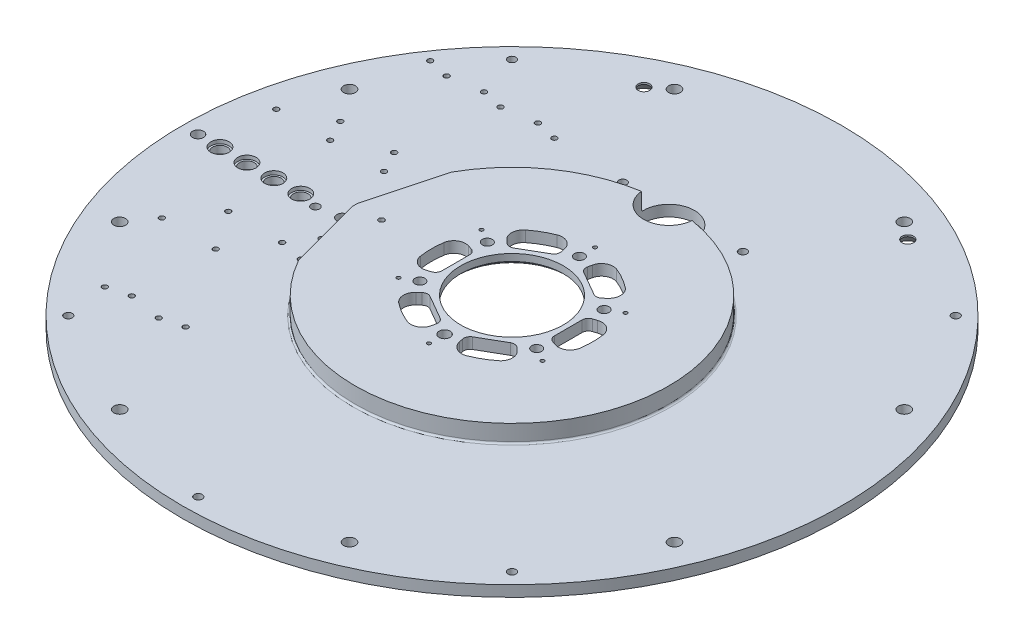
SolidWorks part; units mm, degrees
ref_plane "Front Plane" through (0, 0, 0) normal (0, 0, 1) x (1, 0, 0)
ref_plane "Top Plane" through (0, 0, 0) normal (0, 1, 0) x (1, 0, 0)
ref_plane "Right Plane" through (0, 0, 0) normal (1, 0, 0) x (0, 0, -1)
sketch "Sketch1" plane through (0, 0, 0) normal (0, 0, 1) x (1, 0, 0)
  line L0 (0, 0) -> (0, 40.0271) construction
  line L1 (-67.945, 0) -> (-142.748, 0)
  line L2 (-142.748, 0) -> (-142.748, -4.7625)
  line L3 (-61.9125, -4.7625) -> (-142.748, -4.7625)
  line L4 (-23.8125, 4.6355) -> (-23.8125, 2.8575)
  line L5 (-67.945, 0) -> (-67.945, 7.62)
  line L6 (-67.945, 7.62) -> (-24.003, 7.62)
  line L7 (-61.9125, -4.7625) -> (-61.9125, 2.8575)
  line L8 (-61.9125, 2.8575) -> (-23.8125, 2.8575)
  line L9 (-24.003, 7.62) -> (-22.225, 7.62)
  line L10 (-22.225, 7.62) -> (-22.225, 4.6355)
  line L11 (-22.225, 4.6355) -> (-23.8125, 4.6355)
  dimension "D1" = 285.496
  dimension "D2" = 4.7625
  dimension "D3" = 47.625
  dimension "D4" = 4.7625
  dimension "D5" = 135.89
  dimension "D6" = 123.825
  dimension "D7" = 7.62
  dimension "D8" = 12.3825
  dimension "D9" = 44.45
  dimension "D10" = 1.778
revolve "Revolve1" add sketch "Sketch1" angle 360 about L0
hole_wizard "#8-32 Tapped Hole1" positions "Sketch8" profile "Sketch7" tap size "#8-32" standard "ANSI Inch"
sketch "Sketch8" plane through (0, 0, 0) normal (0, 1, 0) x (1, 0, 0)
  line L0 (0, -135.89) -> (0, 0) construction
  point P0 (0, -135.89)
  dimension "D1" = 135.89
sketch "Sketch7" plane through (0, 0, 135.89) normal (1, 0, 0) x (0, 0, 1)
  line L0 (0, 0) -> (0, 4.7625)
  line L1 (0, 4.7625) -> (1.7272, 4.7625)
  line L2 (1.7272, 4.7625) -> (1.7272, 0)
  line L5 (1.7272, 0) -> (0, 0)
  line L11 (0, -6.35) -> (0, 107.95) construction
  dimension "Thru Tap Drill Dia." = 3.4544
  dimension "Thru Tap Drill Depth" = 4.7625
pattern_circular "CirPattern1" count 8 over 360 about axis through (0, 0, 0) along (0, 1, 0) of "#8-32 Tapped Hole1"
hole_wizard "#8 Clearance Hole1" positions "Sketch10" profile "Sketch9" hole size "#8" standard "ANSI Inch"
sketch "Sketch10" plane through (0, 7.62, 0) normal (0, 1, 0) x (1, 0, 0)
  line L1 (0, 0) -> (-25.2966, 14.605) construction
  circle A0 centre (-25.2966, 14.605) radius 2.0828 construction
  point P4 (-25.2966, 14.605)
sketch "Sketch9" plane through (-25.2966, 7.62, -14.605) normal (1, 0, 0) x (0, 0, 1)
  line L0 (0, 0) -> (0, 12.3825)
  line L1 (0, 12.3825) -> (2.1526, 12.3825)
  line L2 (2.1526, 12.3825) -> (2.1526, 0)
  line L5 (2.1526, 0) -> (0, 0)
  line L11 (0, -6.35) -> (0, 107.95) construction
  dimension "Thru Hole Dia." = 4.3053
  dimension "Thru Hole Depth" = 12.3825
pattern_circular "CirPattern2" count 6 over 360 about axis through (0, 0, 0) along (0, 1, 0) of "#8 Clearance Hole1"
sketch "Sketch11" plane through (0, 2.8575, 0) normal (0, 1, 0) x (1, 0, 0)
  line L0 (0, 0) -> (-18.7551, -20.4676) construction
  line L1 (-13.6339, 0) -> (0, 0) construction
  line L2 (0, 0) -> (-8.3479, -26.4762) construction
  line L3 (0, 0) -> (-25.2966, -14.605) construction
  line L4 (0, -29.21) -> (-12.7026, -22.0015) construction
  line L5 (-12.7026, -22.0015) -> (0, 0) construction
  line L6 (-12.7026, -22.0015) -> (-25.2966, -14.605) construction
  line L7 (0, -29.21) -> (0, 0) construction
  line L8 (-20.5702, -18.4432) -> (-21.8969, -19.6327)
  line L9 (-5.6872, -27.0359) -> (-6.054, -28.7796)
  line L10 (-6.9884, -24.1215) -> (-17.3956, -18.1129)
  line L11 (-12.7026, -22.0015) -> (-17.4625, -30.2459) construction
  line L12 (-6.9884, -24.1215) -> (-12.7026, -22.0015) construction
  line L13 (-12.7026, -22.0015) -> (-17.3956, -18.1129) construction
  arc A0 (-5.6872, -27.0359) -> (-6.9884, -24.1215) centre (-8.3479, -26.4762) ccw
  circle A1 centre (-8.3479, -26.4762) radius 2.719 construction
  arc A3 (-21.6556, -27.4006) -> (-12.9018, -32.4546) centre (0, 0) ccw
  arc A4 (-17.3956, -18.1129) -> (-20.5702, -18.4432) centre (-18.7551, -20.4676) ccw
  arc A5 (-21.6556, -27.4006) -> (-21.8969, -19.6327) centre (-18.5057, -23.415) cw
  arc A6 (-12.9018, -32.4546) -> (-6.054, -28.7796) centre (-11.0252, -27.7339) ccw
  circle A7 centre (0, 0) radius 30.48 construction
  dimension "D3" = 34.925
  dimension "D5" = 5.08
  dimension "D6" = 24.384
  dimension "D7" = 60.96
  dimension "D1" = 25
extrude "Cut-Extrude2" cut sketch "Sketch11" along normal through all
pattern_circular "CirPattern3" count 6 over 360 about axis through (0, 0, 0) along (0, 1, 0) of "Cut-Extrude2"
sketch "Sketch31" plane through (0, 7.62, 0) normal (0, 1, 0) x (1, 0, 0)
  line L0 (0, -29.21) -> (0, 0) construction
  line L1 (0, 0) -> (-25.2966, -14.605) construction
  circle A0 centre (0, -29.21) radius 2.3813
  dimension "D1" = 4.7625
extrude "Cut-Extrude8" cut sketch "Sketch31" against normal through all
hole_wizard "#4-40 Tapped Hole1" positions "Sketch13" profile "Sketch12" tap size "#4-40" standard "ANSI Inch"
sketch "Sketch13" plane through (0, 0, 0) normal (0, 1, 0) x (1, 0, 0)
  line L2 (-100.5717, -22.3329) -> (-77.2384, -22.3329) construction
  line L4 (-112.4873, -39.1996) -> (-89.154, -39.1996) construction
  line L7 (-89.7674, -74.9225) -> (-66.4341, -74.9225) construction
  line L10 (-98.9678, -77.3878) -> (-75.6345, -77.3878) construction
  line L14 (-104.0641, 75.7496) -> (-80.7307, 75.7496) construction
  line L15 (-80.7307, 75.7496) -> (-57.3974, 75.7496) construction
  line L17 (-113.3449, 77.8922) -> (-90.0116, 77.8922) construction
  line L18 (-90.0116, 77.8922) -> (-66.6783, 77.8922) construction
  line L20 (-110.0553, 35.6844) -> (-86.722, 35.6844) construction
  line L21 (-86.722, 35.6844) -> (-63.3886, 35.6844) construction
  line L23 (-81.8279, 26.3861) -> (-105.1613, 26.3861) construction
  line L24 (-105.1613, 26.3861) -> (-128.4946, 26.3861) construction
  circle A32 centre (-113.3449, 77.8922) radius 1.7272 construction
  circle A33 centre (-104.0641, 75.7496) radius 1.7272 construction
  circle A34 centre (-90.0116, 77.8922) radius 1.7272 construction
  circle A35 centre (-80.7307, 75.7496) radius 1.7272 construction
  circle A36 centre (-128.4946, 26.3861) radius 1.4732 construction
  circle A37 centre (-110.0553, 35.6844) radius 1.4732 construction
  circle A38 centre (-105.1613, 26.3861) radius 1.4732 construction
  circle A39 centre (-86.722, 35.6844) radius 1.4732 construction
  circle A40 centre (-112.4873, -39.1996) radius 1.4732 construction
  circle A41 centre (-100.5717, -22.3329) radius 1.4732 construction
  circle A42 centre (-77.2384, -22.3329) radius 1.4732 construction
  circle A43 centre (-89.154, -39.1996) radius 1.4732 construction
  circle A47 centre (-98.9678, -77.3878) radius 1.7272 construction
  circle A48 centre (-89.7674, -74.9225) radius 1.7272 construction
  circle A49 centre (-75.6345, -77.3878) radius 1.7272 construction
  circle A51 centre (-66.4341, -74.9225) radius 1.7272 construction
  point P0 (-98.9678, -77.3878)
  point P2 (-89.7674, -74.9225)
  point P4 (-112.4873, -39.1996)
  point P6 (-100.5717, -22.3329)
  point P8 (-75.6345, -77.3878)
  point P10 (-66.4341, -74.9225)
  point P12 (-89.154, -39.1996)
  point P14 (-77.2384, -22.3329)
  point P16 (-128.4946, 26.3861)
  point P18 (-110.0553, 35.6844)
  point P20 (-104.0641, 75.7496)
  point P22 (-113.3449, 77.8922)
  point P24 (-105.1613, 26.3861)
  point P26 (-86.722, 35.6844)
  point P28 (-80.7307, 75.7496)
  point P30 (-90.0116, 77.8922)
  point P68 (-66.6783, 77.8922)
  point P70 (-57.3974, 75.7496)
  point P72 (-81.8279, 26.3861)
  point P74 (-63.3886, 35.6844)
sketch "Sketch12" plane through (-98.9678, 0, 77.3878) normal (1, 0, 0) x (0, 0, 1)
  line L0 (0, 0) -> (0, 4.7625)
  line L1 (0, 4.7625) -> (1.1303, 4.7625)
  line L2 (1.1303, 4.7625) -> (1.1303, 0)
  line L5 (1.1303, 0) -> (0, 0)
  line L11 (0, -6.35) -> (0, 107.95) construction
  dimension "Thru Tap Drill Dia." = 2.2606
  dimension "Thru Tap Drill Depth" = 4.7625
hole_wizard "#4-40 Tapped Hole2" positions "Sketch15" profile "Sketch14" tap size "#4-40" standard "ANSI Inch"
sketch "Sketch15" plane through (0, 0, 0) normal (0, 1, 0) x (1, 0, 0)
  line L0 (38.1, 85.09) -> (101.6, 85.09) construction
  line L1 (101.6, 85.09) -> (101.6, -85.09) construction
  line L2 (101.6, -85.09) -> (38.1, -85.09) construction
  line L3 (38.1, -85.09) -> (38.1, 85.09) construction
  line L5 (0, 0) -> (38.1, 0) construction
  line L6 (38.1, 0) -> (101.6, 0) construction
  line L8 (19.05, -50.8) -> (19.05, -88.9) construction
  line L9 (19.05, -88.9) -> (19.05, -127) construction
  line L10 (19.05, -127) -> (-19.05, -127) construction
  line L11 (-19.05, -127) -> (-19.05, -88.9) construction
  line L12 (-19.05, -88.9) -> (-19.05, -50.8) construction
  line L13 (-19.05, -50.8) -> (19.05, -50.8) construction
  line L15 (-19.05, -88.9) -> (19.05, -88.9) construction
  line L17 (0, -50.8) -> (0, 0) construction
  point P0 (101.6, -85.09)
  point P2 (101.6, 85.09)
  point P4 (38.1, 85.09)
  point P6 (38.1, -85.09)
  point P26 (19.05, -50.8)
  point P28 (-19.05, -50.8)
  point P30 (-19.05, -88.9)
  point P32 (19.05, -88.9)
  point P34 (19.05, -127)
  point P36 (-19.05, -127)
  dimension "D1" = 170.18
  dimension "D2" = 63.5
  dimension "D3" = 101.6
  dimension "D4" = 38.1
  dimension "D5" = 88.9
sketch "Sketch14" plane through (101.6, 0, 85.09) normal (1, 0, 0) x (0, 0, 1)
  line L0 (0, 0) -> (0, 4.7625)
  line L1 (0, 4.7625) -> (1.1303, 4.7625)
  line L2 (1.1303, 4.7625) -> (1.1303, 0)
  line L5 (1.1303, 0) -> (0, 0)
  line L11 (0, -6.35) -> (0, 107.95) construction
  dimension "Thru Tap Drill Dia." = 2.2606
  dimension "Thru Tap Drill Depth" = 4.7625
hole_wizard "CSK for #6 Flat Head Machine Screw2" positions "Sketch17" profile "Sketch16" countersink size "#6" standard "ANSI Inch"
sketch "Sketch17" plane through (0, 0, 0) normal (0, 1, 0) x (1, 0, 0)
  line L0 (-135.901, 9.525) -> (-135.901, -9.525) construction
  line L2 (-135.901, 0) -> (-63.511, 0) construction
  line L3 (-63.511, 0) -> (0, 0) construction
  line L5 (-62.241, 9.525) -> (-62.241, -9.525) construction
  point P12 (-62.241, 9.525)
  point P14 (-135.901, -9.525)
  point P16 (-135.901, 9.525)
  point P40 (-62.241, -9.525)
sketch "Sketch16" plane through (-62.241, 0, -9.525) normal (1, 0, 0) x (0, 0, 1)
  line L0 (0, 0) -> (0, 4.7625)
  line L1 (0, 4.7625) -> (1.8288, 4.7625)
  line L2 (1.8288, 4.7625) -> (1.8288, 1.9723)
  line L3 (1.8288, 1.9723) -> (3.5433, 0)
  line L5 (3.5433, 0) -> (0, 0)
  line L6 (-1.8288, 1.9723) -> (-3.5433, 0) construction
  line L11 (0, -6.35) -> (0, 107.95) construction
  dimension "Thru Hole Dia." = 3.6576
  dimension "Thru Hole Depth" = 4.7625
  dimension "Near C'Sink Dia." = 7.0866
  dimension "Near C'Sink Angle" = 82
sketch "Sketch5" plane through (0, 0, 0) normal (0, 1, 0) x (1, 0, 0)
  line L0 (-73.441, -3.81) -> (-135.941, -3.81)
  line L1 (-73.441, 3.81) -> (-135.941, 3.81)
  line L2 (-135.941, 0) -> (-73.441, 0) construction
  line L3 (-112.4873, -39.1996) -> (-100.5717, -22.3329) construction
  line L4 (-98.9678, -77.3878) -> (-89.7674, -74.9225) construction
  line L5 (-94.3676, -76.1551) -> (-106.5295, -30.7663) construction
  line L6 (-106.5295, -30.7663) -> (-135.941, 0) construction
  line L7 (-63.3886, 35.6844) -> (-81.8279, 26.3861) construction
  line L8 (-57.3974, 75.7496) -> (-66.6783, 77.8922) construction
  line L9 (-62.0378, 76.8209) -> (-72.6083, 31.0352) construction
  line L10 (-74.6487, 30.0063) -> (-73.441, 0) construction
  arc A0 (-73.441, -3.81) -> (-73.441, 3.81) centre (-73.441, 0) ccw
  arc A1 (-135.941, 3.81) -> (-135.941, -3.81) centre (-135.941, 0) ccw
  circle A2 centre (-73.441, 0) radius 2.3812 construction
  circle A3 centre (-135.941, 0) radius 2.3813 construction
  dimension "D1" = 7.62
extrude "Cut-Extrude1" [suppressed] cut sketch "Sketch5" against normal through all
hole_wizard "CSK for #10 Flat Head Machine Screw1" positions "Sketch19" profile "Sketch18" countersink size "#10" standard "ANSI Inch"
sketch "Sketch19" plane through (0, -4.7625, 0) normal (0, -1, 0) x (-1, 0, 0)
  line L0 (57.15, 114.3) -> (-57.15, 114.3) construction
  line L1 (-57.15, 114.3) -> (-57.15, -114.3) construction
  line L3 (57.15, -114.3) -> (57.15, 114.3) construction
  line L5 (57.15, 0) -> (0, 0) construction
  line L6 (0, 0) -> (0, 114.3) construction
  point P4 (-57.15, 114.3)
  point P6 (57.15, 114.3)
  dimension "D1" = 114.3
  dimension "D2" = 114.3
sketch "Sketch18" plane through (57.15, -4.7625, -114.3) normal (1, 0, 0) x (0, 0, -1)
  line L0 (0, 0) -> (0, 12.3825)
  line L1 (0, 12.3825) -> (2.4892, 12.3825)
  line L2 (2.4892, 12.3825) -> (2.4892, 4.0312)
  line L3 (2.4892, 4.0312) -> (5.9935, 0)
  line L5 (5.9935, 0) -> (0, 0)
  line L6 (-2.4892, 4.0312) -> (-5.9935, 0) construction
  line L11 (0, -6.35) -> (0, 107.95) construction
  dimension "Thru Hole Dia." = 4.9784
  dimension "Thru Hole Depth" = 12.3825
  dimension "Near C'Sink Dia." = 11.987
  dimension "Near C'Sink Angle" = 82
sketch "Sketch20" plane through (0, -4.7625, 0) normal (0, -1, 0) x (1, 0, 0)
  circle A0 centre (0, 0) radius 139.7
  dimension "D1" = 279.4
extrude "Cut-Extrude3" [suppressed] cut sketch "Sketch20" against normal blind 0.127 flip side to cut
sketch "Sketch21" plane through (0, 0, 0) normal (0, 1, 0) x (1, 0, 0)
  line L0 (-66.6783, 77.8922) -> (-57.3974, 75.7496) construction
  line L1 (-63.3886, 35.6844) -> (-81.8279, 26.3861) construction
  line L2 (-62.0378, 76.8209) -> (-72.6083, 31.0352) construction
  line L3 (0, 0) -> (-165.1234, 0) construction
  line L4 (-66.4341, -74.9225) -> (-75.6345, -77.3878) construction
  line L5 (-77.2384, -22.3329) -> (-89.154, -39.1996) construction
  line L6 (-100.5717, -22.3329) -> (-112.4873, -39.1996) construction
  line L7 (-89.7674, -74.9225) -> (-98.9678, -77.3878) construction
  line L8 (-71.0343, -76.1551) -> (-83.1962, -30.7663) construction
  line L9 (-94.3676, -76.1551) -> (-106.5295, -30.7663) construction
  line L10 (-90.0116, 77.8922) -> (-80.7307, 75.7496) construction
  line L11 (-85.3712, 76.8209) -> (-95.9416, 31.0352) construction
  line L12 (-86.722, 35.6844) -> (-105.1613, 26.3861) construction
  line L13 (-119.2749, 31.0352) -> (-108.7045, 76.8209) construction
  line L14 (-110.0553, 35.6844) -> (-128.4946, 26.3861) construction
  line L15 (-95.9416, 31.0352) -> (-103.1067, 0) construction
  line L16 (-113.3449, 77.8922) -> (-104.0641, 75.7496) construction
  line L17 (-119.2749, 31.0352) -> (-126.44, 0) construction
  line L18 (-106.5295, -30.7663) -> (-114.7733, 0) construction
  line L19 (-83.1962, -30.7663) -> (-91.44, 0) construction
  dimension "D1" = 114.7733
  dimension "D2" = 126.44
  dimension "D3" = 91.44
  dimension "D4" = 103.1067
sketch "Sketch22" plane through (0, 0, 0) normal (0, 1, 0) x (1, 0, 0)
  line L0 (0, 0) -> (-165.1234, 0) construction
  line L1 (-103.1667, 0) -> (-114.8333, 0) construction
  line L2 (-103.1667, 0) -> (-91.5, 0) construction
  line L3 (-114.8333, 0) -> (-126.5, 0) construction
  line L4 (-91.5, 0) -> (-79.8333, 0) construction
  line L5 (-83.5, 1) -> (-79.8333, 0) construction
  line L6 (-63.3886, 35.6844) -> (-81.8279, 26.3861) construction
  line L7 (-72.6083, 31.0352) -> (-79.8333, 0) construction
  line L8 (-83.5, -1.65) -> (-83.5, 0) construction
  line L9 (-83.5, 0) -> (-91.5, 0) construction
  circle A0 centre (-126.5, 0) radius 3.175
  circle A1 centre (-114.8333, 0) radius 3.175
  circle A2 centre (-91.5, 0) radius 3.175
  circle A3 centre (-103.1667, 0) radius 3.175
  circle A4 centre (-136, 0) radius 2.3813
  circle A5 centre (-73.5, 0) radius 2.3813
  circle A6 centre (-83.5, 1) radius 1.7856 construction
  circle A7 centre (0, 0) radius 142.748 construction
  circle A8 centre (-83.5, -1.65) radius 1.785
  point P2 (-79.8333, 0)
  point P27 (-77.8959, 0)
  dimension "D1" = 6.35
  dimension "D2" = 4.7625
  dimension "D3" = 136
  dimension "D4" = 35
  dimension "D5" = 1
  dimension "D6" = 18
  dimension "D7" = 3.5712
  dimension "D8" = 8
  dimension "D9" = 62.5
  dimension "D11" = 3.57
  dimension "D12" = 8
  dimension "D10" = 87.85
  dimension "```" = 52.5
  dimension "D13" = 1.65
extrude "Cut-Extrude4" cut sketch "Sketch22" against normal through all
sketch "Sketch23" plane through (0, 0, 0) normal (0, 1, 0) x (1, 0, 0)
  circle A0 centre (-73.5, 0) radius 3.9687
  circle A1 centre (-136, 0) radius 3.9687
  dimension "D1" = 7.9375
extrude "Cut-Extrude5" [suppressed] cut sketch "Sketch23" against normal blind 3.175
sketch "Sketch24" plane through (0, 0, 0) normal (0, 1, 0) x (1, 0, 0)
  line L0 (-91.5, 0) -> (-114.7733, 0) construction
  line L1 (-73.5, 0) -> (-59.381, -52.6927) construction
  line L2 (-91.5, 0) -> (-68.2267, 0) construction
  line L3 (0, 0) -> (-165.1234, 0) construction
  line L4 (-68.2267, 0) -> (-44.9642, 86.8168)
  line L5 (-68.2267, 0) -> (-44.9642, -86.8168)
  arc A0 (-44.9642, 86.8168) -> (-44.9642, -86.8168) centre (0, 0) ccw
  circle A1 centre (-91.5, 0) radius 3.175 construction
  dimension "D1" = 75
  dimension "D2" = 10.1873
extrude "Cut-Extrude6" cut sketch "Sketch24" along normal through all
sketch "Sketch26" plane through (0, -4.7625, 0) normal (0, -1, 0) x (1, 0, 0)
  line L0 (0, -68) -> (0, 0) construction
  circle A0 centre (0, -68) radius 11
  dimension "D1" = 22
  dimension "D2" = 68
extrude "Cut-Extrude7" cut sketch "Sketch26" against normal through all
chamfer "Chamfer2" distance 0.254 angle 45 1 edges at (0, 2.8575, -23.8125)
hole_wizard "#6-32 Tapped Hole1" positions "Sketch33" profile "Sketch32" tap size "#6-32" standard "ANSI Inch"
sketch "Sketch33" plane through (0, 7.62, 0) normal (0, 1, 0) x (1, 0, 0)
  line L0 (-43.9998, 18.2253) -> (0, 0) construction
  line L1 (0, 0) -> (-43.9998, -18.2253) construction
  line L2 (-43.9998, -18.2253) -> (-43.9998, 18.2253) construction
  line L4 (-43.9998, 0) -> (0, 0) construction
  point P0 (-43.9998, -18.2253)
  point P2 (-43.9998, 18.2253)
  dimension "D1" = 47.625
  dimension "D2" = 45
sketch "Sketch32" plane through (-43.9998, 7.62, 18.2253) normal (1, 0, 0) x (0, 0, 1)
  line L0 (0, 0) -> (0, 12.3825)
  line L1 (0, 12.3825) -> (1.3525, 12.3825)
  line L2 (1.3525, 12.3825) -> (1.3525, 0)
  line L5 (1.3525, 0) -> (0, 0)
  line L11 (0, -6.35) -> (0, 107.95) construction
  dimension "Thru Tap Drill Dia." = 2.7051
  dimension "Thru Tap Drill Depth" = 12.3825
hole_wizard "#8-32 Tapped Hole2" positions "Sketch35" profile "Sketch34" tap size "#8-32" standard "ANSI Inch"
sketch "Sketch35" plane through (0, 0, 0) normal (0, 1, 0) x (1, 0, 0)
  line L0 (26, 74) -> (0, 74) construction
  line L2 (0, 74) -> (-26, 74) construction
  line L3 (0, 68) -> (0, 74) construction
  point P0 (26, 74)
  point P2 (-26, 74)
  dimension "D1" = 26
  dimension "D2" = 6
sketch "Sketch34" plane through (26, 0, -74) normal (1, 0, 0) x (0, 0, 1)
  line L0 (0, 0) -> (0, 4.7625)
  line L1 (0, 4.7625) -> (1.7272, 4.7625)
  line L2 (1.7272, 4.7625) -> (1.7272, 0)
  line L5 (1.7272, 0) -> (0, 0)
  line L11 (0, -6.35) -> (0, 107.95) construction
  dimension "Thru Tap Drill Dia." = 3.4544
  dimension "Thru Tap Drill Depth" = 4.7625
fillet "Fillet1" radius 0.762 6 edges at (-63.6563, 0, 17.0567) (-67.945, 0, 0) (-63.6563, 0, -17.0567) (-39.0667, 0, -55.5906) (55.5906, 0, 39.0667) (0, 2.8575, 61.9125)
chamfer "Chamfer3" distance 1.016 angle 45 1 edges at (0, -4.7625, 61.9125)
sketch "Sketch36" plane through (0, 0, 0) normal (0, 1, 0) x (1, 0, 0)
  circle A0 centre (-91.5, 0) radius 3.9687
  circle A1 centre (-103.1667, 0) radius 3.9688
  circle A2 centre (-114.8333, 0) radius 3.9688
  circle A3 centre (-126.5, 0) radius 3.9687
  dimension "D1" = 7.9375
extrude "Cut-Extrude9" cut sketch "Sketch36" against normal blind 1.5875
sketch "Sketch37" plane through (0, 7.62, 0) normal (0, 1, 0) x (1, 0, 0)
  line L0 (-56.515, 0) -> (0, 0) construction
  circle A0 centre (-56.515, 0) radius 1.1906
  dimension "D2" = 2.3813
  dimension "D1" = 56.515
extrude "Cut-Extrude10" cut sketch "Sketch37" against normal blind 10
hole_wizard "M2x0.4 Tapped Hole1" positions "Sketch38" profile "Sketch39" tap size "M2x0.4" standard "ANSI Metric"
sketch "Sketch38" plane through (0, 2.8575, 0) normal (0, -1, 0) x (-1, 0, 0)
  line L0 (0, -36) -> (0, 0) construction
  line L1 (0, 0) -> (48.0693, 0) construction
  circle A0 centre (0, 0) radius 36 construction
  point P5 (0, -36)
  point P24 (-31.1769, -18)
  point P25 (-31.1769, 18)
  point P26 (0, 36)
  point P27 (31.1769, 18)
  point P28 (31.1769, -18)
  point P29 (0, 0)
  dimension "D1" = 72
  dimension "D2" = 6
sketch "Sketch39" plane through (0, 2.8575, 0) normal (1, 0, 0) x (0, 0, -1)
  line L0 (0, 0) -> (0, 4.7625)
  line L1 (0, 4.7625) -> (0.8, 4.7625)
  line L2 (0.8, 4.7625) -> (0.8, 0)
  line L5 (0.8, 0) -> (0, 0)
  line L11 (0, -6.35) -> (0, 107.95) construction
  dimension "Thru Tap Drill Dia." = 1.6
  dimension "Thru Tap Drill Depth" = 4.7625
hole_wizard "#10 Clearance Hole1" positions "Sketch40" profile "Sketch41" hole size "#10" standard "ANSI Inch"
sketch "Sketch40" plane through (0, -4.7625, 0) normal (0, -1, 0) x (-1, 0, 0)
  line L0 (0, 0) -> (-151.4287, 0) construction
  line L2 (0, 0) -> (-120.1487, 49.7672) construction
  point P0 (-120.1487, 49.7672)
  point P19 (-49.7672, 120.1487)
  point P20 (49.7672, 120.1487)
  point P21 (120.1487, 49.7672)
  point P22 (120.1487, -49.7672)
  point P23 (49.7672, -120.1487)
  point P24 (-49.7672, -120.1487)
  point P25 (-120.1487, -49.7672)
  point P26 (0, 0)
  dimension "D1" = 22.5
  dimension "D2" = 130.048
  dimension "D3" = 8
sketch "Sketch41" plane through (120.1487, -4.7625, -49.7672) normal (1, 0, 0) x (0, 0, -1)
  line L0 (0, 0) -> (0, 12.3825)
  line L1 (0, 12.3825) -> (2.5527, 12.3825)
  line L2 (2.5527, 12.3825) -> (2.5527, 0)
  line L5 (2.5527, 0) -> (0, 0)
  line L11 (0, -6.35) -> (0, 107.95) construction
  dimension "Thru Hole Dia." = 5.1054
  dimension "Thru Hole Depth" = 12.3825
hole_wizard "#4-40 Tapped Hole3" positions "Sketch42" profile "Sketch43" tap size "#4-40" standard "ANSI Inch"
sketch "Sketch42" plane through (0, 0, 0) normal (0, 1, 0) x (1, 0, 0)
  line L0 (-66.926, -24.5345) -> (-70.213, -12.2673) construction
  line L1 (-70.213, -12.2673) -> (-73.5, 0) construction
  line L3 (-59.3763, -33.0299) -> (-67.9364, -1.0834) construction
  point P0 (-70.213, -12.2673)
  point P2 (-66.926, -24.5345)
  dimension "D1" = 12.7
  dimension "D2" = 12.7
sketch "Sketch43" plane through (-70.213, 0, 12.2673) normal (1, 0, 0) x (0, 0, 1)
  line L0 (0, 0) -> (0, 4.7625)
  line L1 (0, 4.7625) -> (1.1303, 4.7625)
  line L2 (1.1303, 4.7625) -> (1.1303, 0)
  line L5 (1.1303, 0) -> (0, 0)
  line L11 (0, -6.35) -> (0, 107.95) construction
  dimension "Thru Tap Drill Dia." = 2.2606
  dimension "Thru Tap Drill Depth" = 4.7625
sketch "Sketch44" plane through (0, 0, 0) normal (0, 1, 0) x (1, 0, 0)
  line L0 (0, 0) -> (-136, 0) construction
  line L1 (0, 0) -> (-135.255, -14.2159) construction
  line L2 (0, 0) -> (-133.0281, -28.276) construction
  line L6 (0, 0) -> (-131.2597, -35.1709) construction
  line L8 (-135.5792, -19.05) -> (-141.3594, -19.8622)
  line L9 (-135.5792, -19.05) -> (-119.1481, -80.3719) construction
  line L10 (-59.3763, -33.0299) -> (-67.9364, -1.0834) construction
  line L11 (0, 0) -> (-124.8042, -47.9078) construction
  line L12 (-113.502, -76.5633) -> (-118.3409, -79.8275)
  circle A0 centre (-136, 0) radius 2.3813 construction
  circle A1 centre (-135.255, -14.2159) radius 2.3813 construction
  circle A2 centre (-133.0281, -28.276) radius 2.3813 construction
  circle A3 centre (-136, 0) radius 2.3813 construction
  circle A4 centre (-136, 0) radius 3.175 construction
  arc A5 (-141.3594, -19.8622) -> (-118.3409, -79.8275) centre (0, 0) ccw
  circle A6 centre (0, 0) radius 142.748 construction
  arc A9 (-135.5792, -19.05) -> (-113.502, -76.5633) centre (0, 0) ccw
  point P25 (-135.5792, -19.05)
  dimension "D3" = 6.35
  dimension "D7" = 21
  dimension "D1" = 6
  dimension "D2" = 12
  dimension "D4" = 19.05
  dimension "D5" = 135.89
extrude "Cut-Extrude11" [suppressed] cut sketch "Sketch44" against normal through all
chamfer "Chamfer4" [suppressed] distance 3.81 angle 70
chamfer "Chamfer6" [suppressed] distance 3.81 angle 45
fillet "Fillet2" [suppressed] radius 76.2
fillet "Fillet7" [suppressed] radius 1.5875
fillet "Fillet6" [suppressed] radius 6.35
fillet "Fillet8" [suppressed] radius 6.35
